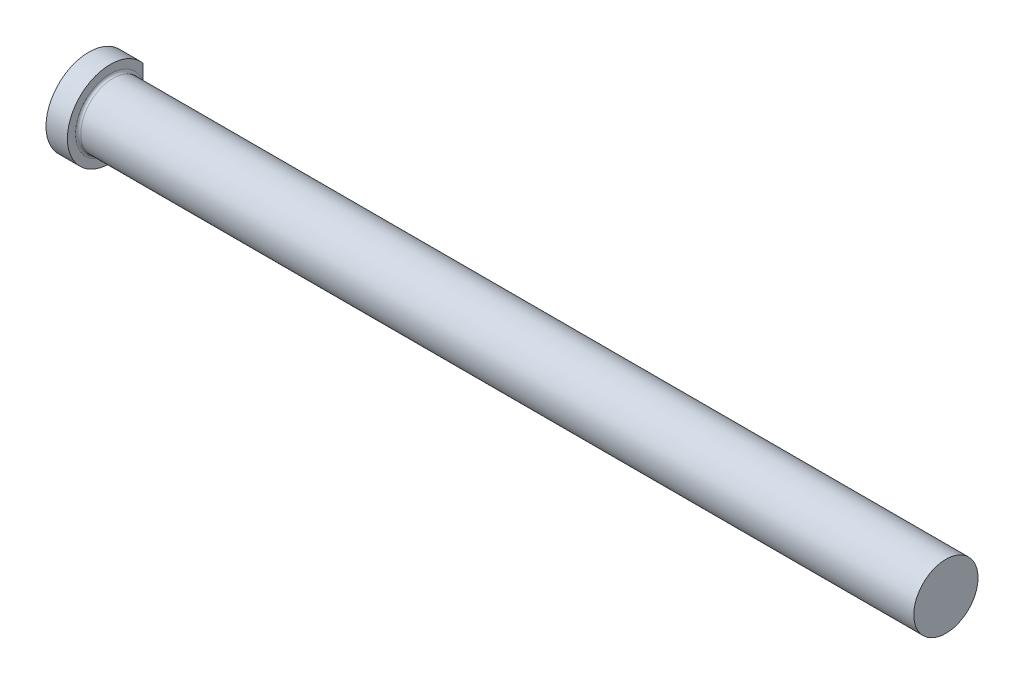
SolidWorks part; units mm, degrees
ref_plane "Front Plane" through (0, 0, 0) normal (0, 0, 1) x (1, 0, 0)
ref_plane "Top Plane" through (0, 0, 0) normal (0, 1, 0) x (1, 0, 0)
ref_plane "Right Plane" through (0, 0, 0) normal (1, 0, 0) x (0, 0, -1)
sketch "Sketch1" plane through (0, 0, 0) normal (0, 0, 1) x (1, 0, 0)
  line L0 (0, 0) -> (0, 12.7)
  line L1 (0, 12.7) -> (6.35, 12.7)
  line L2 (6.35, 12.7) -> (6.35, 10.3061)
  line L3 (7.1374, 9.5186) -> (254, 9.5186)
  line L4 (254, 9.5186) -> (254, 0)
  line L5 (254, 0) -> (0, 0)
  line L6 (254, 0) -> (0, 0) construction
  line L7 (0, 0) -> (-10.4771, 0) construction
  line L8 (254, 0) -> (1002.3976, 0) construction
  line L9 (7.1374, 9.5186) -> (-7.9138, 9.5186) construction
  arc A0 (7.1374, 9.5186) -> (6.35, 10.3061) centre (7.1374, 10.3061) cw
  dimension "D1" = 0.7874
  dimension "HeadDia" = 25.4
  dimension "HeadThickness" = 6.35
  dimension "PinDia" = 19.0373
  dimension "overall" = 254
revolve "PIN" add sketch "Sketch1" angle 360 about L6
ref_plane "Plane1" through (130.5687, 0, -9.5186) normal (0, 0, -1) x (0, -1, 0)
ref_plane "CutPlane" through (0, 0, -9.6964) normal (0, 0, -1) x (-1, 0, 0)
other "SurfaceCut1"
